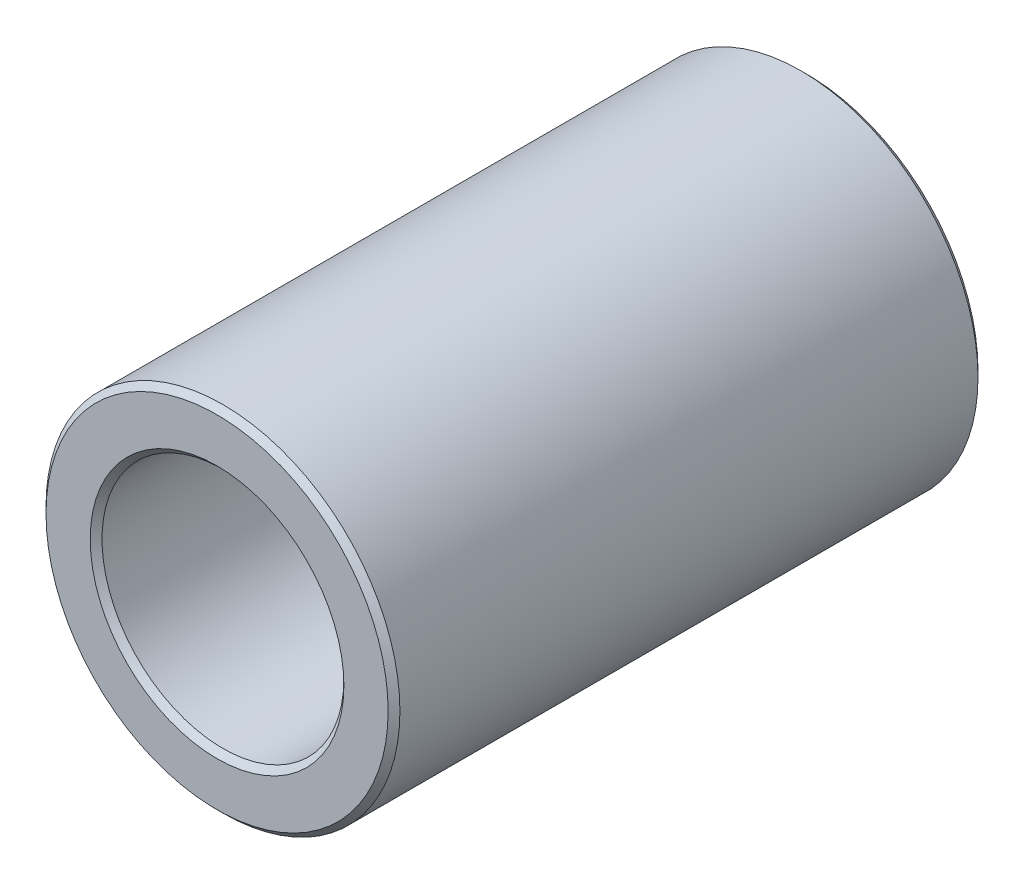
SolidWorks part; units mm, degrees
ref_plane "Front Plane" through (0, 0, 0) normal (0, 0, 1) x (1, 0, 0)
ref_plane "Top Plane" through (0, 0, 0) normal (0, 1, 0) x (1, 0, 0)
ref_plane "Right Plane" through (0, 0, 0) normal (1, 0, 0) x (0, 0, -1)
sketch "Sketch1" plane through (0, 0, 0) normal (0, 0, 1) x (1, 0, 0)
  circle A0 centre (0, 0) radius 6
  circle A1 centre (0, 0) radius 4.1
  dimension "D1" = 12
  dimension "D2" = 8.2
extrude "Boss-Extrude2" add sketch "Sketch1" along normal mid plane 20
chamfer "Chamfer3" distance 0.2 angle 45 4 edges at (6, 0, 10) (6, 0, -10) (4.1, 0, -10) (4.1, 0, 10)
